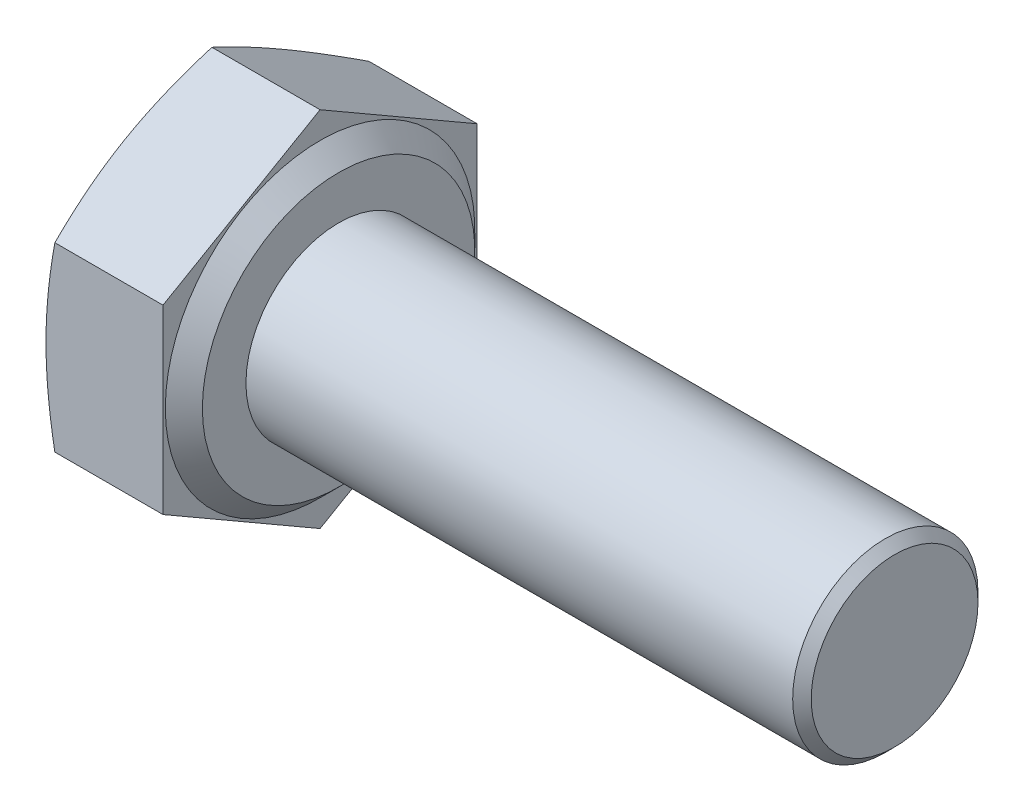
SolidWorks part; units mm, degrees
ref_plane "Front" through (0, 0, 0) normal (0, 0, 1) x (1, 0, 0)
ref_plane "Top" through (0, 0, 0) normal (0, 1, 0) x (1, 0, 0)
ref_plane "Right" through (0, 0, 0) normal (1, 0, 0) x (0, 0, -1)
sketch "Sketch2" plane through (0, 0, 0) normal (1, 0, 0) x (0, 0, -1)
  line L1 (3.39, -1.9572) -> (3.39, 1.9572)
  line L2 (3.39, 1.9572) -> (0, 3.9144)
  line L3 (0, 3.9144) -> (-3.39, 1.9572)
  line L4 (-3.39, 1.9572) -> (-3.39, -1.9572)
  line L5 (-3.39, -1.9572) -> (0, -3.9144)
  line L6 (0, -3.9144) -> (3.39, -1.9572)
  circle A0 centre (0, 0) radius 3.39 construction
  dimension "s" = 6.78
extrude "BaseHead" add sketch "Sketch2" along normal blind 2.925
sketch "Sketch3" plane through (0, 0, 0) normal (0, 0, 1) x (1, 0, 0)
  line L0 (2.925, 3.9144) -> (2.925, 2.94)
  line L2 (2.925, 2.94) -> (2.525, 3.34)
  line L3 (2.525, 3.34) -> (2.525, 3.9144)
  line L5 (2.525, 3.9144) -> (2.925, 3.9144)
  line L6 (-0.9571, 0) -> (7.6478, 0) construction
  line L7 (2.925, 3.9144) -> (0, 3.9144) construction
  dimension "D1" = 45
  dimension "c" = 0.4
  dimension "Dw" = 2.94
revolve "BearingFace" cut sketch "Sketch3" angle 360 about L6
sketch "Sketch4" plane through (0, 0, 0) normal (0, 0, 1) x (1, 0, 0)
  line L0 (-0.4935, 0) -> (3.5626, 0) construction
  line L2 (0, 3.9144) -> (0.1909, 3.9144)
  line L4 (0.1909, 3.9144) -> (0, 3.39)
  line L6 (0, 3.39) -> (0, 3.9144)
  line L7 (2.525, 3.9144) -> (0, 3.9144) construction
  dimension "D1" = 20
  dimension "D2" = 6.78
revolve "HeadChamfer" cut sketch "Sketch4" angle 360 about L0
sketch "Sketch5" plane through (2.925, 0, 0) normal (1, 0, 0) x (0, 0, -1)
  circle A0 centre (0, 0) radius 2
  dimension "d" = 4
extrude "BaseBody" add sketch "Sketch5" along normal blind 12
chamfer "Chamfer1" distance 0.2 angle 45 1 edges at (14.925, 0, -2)
fillet "HeadFillet" [suppressed] radius 0.2
sketch "Sketch6" plane through (0, 0, 0) normal (0, 0, 1) x (1, 0, 0)
  line L0 (2.925, 2.379) -> (3.304, 2.379)
  line L1 (3.304, 2.379) -> (3.304, 2)
  line L2 (3.304, 2) -> (3.1145, 1.6718)
  line L3 (3.1145, 1.6718) -> (2.925, 2)
  line L4 (2.925, 2) -> (2.925, 2.379)
  line L5 (14.725, 2) -> (2.925, 2) construction
  line L6 (2.925, -2.94) -> (2.925, 2.94) construction
  dimension "D1" = 0.379
revolve "Cut-Revolve10" [suppressed] cut sketch "Sketch6" angle 360 about axis through (-0.9571, 0, 0) along (1, 0, 0)
pattern_linear "LPattern10" [suppressed] count 26
equation "\"D2@Sketch4\" = \"s@Sketch2\""
equation "\"D1@Chamfer1\" = 0.05 * \"d@Sketch5\""
equation "\"D1@Sketch6\" =  ( \"d@Sketch5\" - \"D2@ThreadCosmetic1\" )  / 2"
equation "\"pitch@LPattern10\" = \"D1@Sketch6\" * 1.2"
equation "\"D1@LPattern10\" = \"l@BaseBody\" / \"pitch@LPattern10\""
